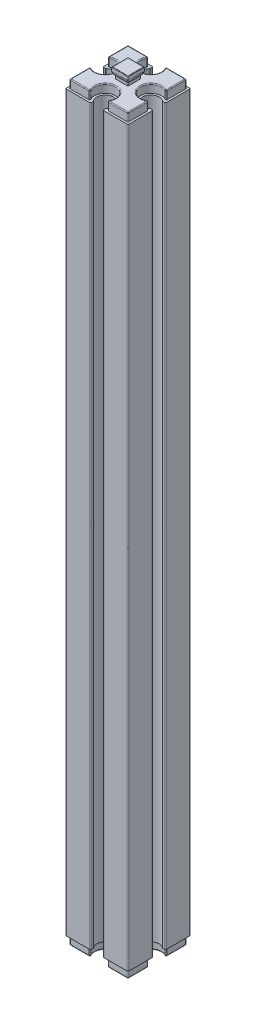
SolidWorks part; units mm, degrees
ref_plane "前视基准面" through (0, 0, 0) normal (0, 0, 1) x (1, 0, 0)
ref_plane "上视基准面" through (0, 0, 0) normal (0, 1, 0) x (1, 0, 0)
ref_plane "右视基准面" through (0, 0, 0) normal (1, 0, 0) x (0, 0, -1)
sketch "草图1" plane through (0, 0, 0) normal (0, 1, 0) x (1, 0, 0)
  line L0 (0, 0) -> (0, 7.5) construction
  line L1 (0, 0) -> (7.5, 0) construction
  line L2 (-7.5, 7.5) -> (-1.5, 7.5)
  line L3 (7.5, 7.5) -> (7.5, 1.5)
  line L4 (6.8229, 1.5) -> (7.5, 1.5)
  line L5 (6.8229, -1.5) -> (7.5, -1.5)
  line L6 (0, 7.5) -> (0, 5.5) construction
  line L7 (-1.5, 6.8229) -> (-1.5, 7.5)
  line L8 (1.5, 6.8229) -> (1.5, 7.5)
  line L9 (1.5, 7.5) -> (7.5, 7.5)
  line L10 (7.5, -1.5) -> (7.5, -7.5)
  line L11 (7.5, -7.5) -> (1.5, -7.5)
  line L12 (1.5, -6.8229) -> (1.5, -7.5)
  line L13 (-1.5, -6.8229) -> (-1.5, -7.5)
  line L14 (-1.5, -7.5) -> (-7.5, -7.5)
  line L15 (-7.5, -7.5) -> (-7.5, -1.5)
  line L16 (-6.8229, -1.5) -> (-7.5, -1.5)
  line L17 (-6.8229, 1.5) -> (-7.5, 1.5)
  line L18 (-7.5, 1.5) -> (-7.5, 7.5)
  arc A0 (-1.5, 6.8229) -> (1.5, 6.8229) centre (0, 5.5) ccw
  arc A1 (6.8229, 1.5) -> (6.8229, -1.5) centre (5.5, 0) ccw
  arc A2 (1.5, -6.8229) -> (-1.5, -6.8229) centre (0, -5.5) ccw
  arc A3 (-6.8229, -1.5) -> (-6.8229, 1.5) centre (-5.5, 0) ccw
  point P36 (0, 0)
  dimension "D6" = 4
  dimension "D7" = 2
  dimension "D1" = 7.5
  dimension "D2" = 7.5
  dimension "D3" = 2
  dimension "D4" = 7.5
  dimension "D5" = 1.5
extrude "凸台-拉伸1" add sketch "草图1" along normal blind 88
sketch "草图2" plane through (0, 88, 0) normal (0, 1, 0) x (1, 0, 0)
  line L0 (-7, 7) -> (-7, 2)
  line L1 (-7, 2) -> (-7, 2)
  line L2 (-7, -2) -> (-7, -2)
  line L3 (-7, -2) -> (-7, -7)
  line L4 (-7, -7) -> (-2, -7)
  line L5 (-2, -7) -> (-2, -7)
  line L6 (2, -7) -> (2, -7)
  line L7 (2, -7) -> (7, -7)
  line L8 (7, -7) -> (7, -2)
  line L9 (7, -2) -> (7, -2)
  line L10 (7, 2) -> (7, 2)
  line L11 (7, 2) -> (7, 7)
  line L12 (7, 7) -> (2, 7)
  line L13 (2, 7) -> (2, 7)
  line L14 (-2, 7) -> (-2, 7)
  line L15 (-2, 7) -> (-7, 7)
  line L16 (-7.5, 7.5) -> (-7.5, 1.5)
  line L17 (-7.5, 1.5) -> (-6.8229, 1.5)
  line L18 (-6.8229, -1.5) -> (-7.5, -1.5)
  line L19 (-7.5, -1.5) -> (-7.5, -7.5)
  line L20 (-7.5, -7.5) -> (-1.5, -7.5)
  line L21 (-1.5, -7.5) -> (-1.5, -6.8229)
  line L22 (1.5, -6.8229) -> (1.5, -7.5)
  line L23 (1.5, -7.5) -> (7.5, -7.5)
  line L24 (7.5, -7.5) -> (7.5, -1.5)
  line L25 (7.5, -1.5) -> (6.8229, -1.5)
  line L26 (6.8229, 1.5) -> (7.5, 1.5)
  line L27 (7.5, 1.5) -> (7.5, 7.5)
  line L28 (7.5, 7.5) -> (1.5, 7.5)
  line L29 (1.5, 7.5) -> (1.5, 6.8229)
  line L30 (-1.5, 6.8229) -> (-1.5, 7.5)
  line L31 (-1.5, 7.5) -> (-7.5, 7.5)
  line L32 (-7.5, 7.5) -> (-7.5, 1.5) construction
  line L33 (-7.5, 1.5) -> (-6.8229, 1.5) construction
  line L34 (-6.8229, -1.5) -> (-7.5, -1.5) construction
  line L35 (-7.5, -1.5) -> (-7.5, -7.5) construction
  line L36 (-7.5, -7.5) -> (-1.5, -7.5) construction
  line L37 (-1.5, -7.5) -> (-1.5, -6.8229) construction
  line L38 (1.5, -6.8229) -> (1.5, -7.5) construction
  line L39 (1.5, -7.5) -> (7.5, -7.5) construction
  line L40 (7.5, -7.5) -> (7.5, -1.5) construction
  line L41 (7.5, -1.5) -> (6.8229, -1.5) construction
  line L42 (6.8229, 1.5) -> (7.5, 1.5) construction
  line L43 (7.5, 1.5) -> (7.5, 7.5) construction
  line L44 (7.5, 7.5) -> (1.5, 7.5) construction
  line L45 (1.5, 7.5) -> (1.5, 6.8229) construction
  line L46 (-1.5, 6.8229) -> (-1.5, 7.5) construction
  line L47 (-1.5, 7.5) -> (-7.5, 7.5) construction
  arc A0 (-7, -2) -> (-7, 2) centre (-5.5, 0) ccw
  arc A1 (2, -7) -> (-2, -7) centre (0, -5.5) ccw
  arc A2 (7, 2) -> (7, -2) centre (5.5, 0) ccw
  arc A3 (-2, 7) -> (2, 7) centre (0, 5.5) ccw
  arc A4 (-6.8229, -1.5) -> (-6.8229, 1.5) centre (-5.5, 0) ccw
  arc A5 (1.5, -6.8229) -> (-1.5, -6.8229) centre (0, -5.5) ccw
  arc A6 (6.8229, 1.5) -> (6.8229, -1.5) centre (5.5, 0) ccw
  arc A7 (-1.5, 6.8229) -> (1.5, 6.8229) centre (0, 5.5) ccw
  arc A8 (-6.8229, -1.5) -> (-6.8229, 1.5) centre (-5.5, 0) ccw construction
  arc A9 (1.5, -6.8229) -> (-1.5, -6.8229) centre (0, -5.5) ccw construction
  arc A10 (6.8229, 1.5) -> (6.8229, -1.5) centre (5.5, 0) ccw construction
  arc A11 (-1.5, 6.8229) -> (1.5, 6.8229) centre (0, 5.5) ccw construction
  dimension "D1" = 0
  dimension "D2" = 0.5
extrude "凸台-拉伸2" add sketch "草图2" along normal blind 2
sketch "草图3" plane through (0, 0, 0) normal (1, 0, 0) x (0, 0, -1)
  line L0 (0, 90) -> (0, 92) construction
  line L1 (2.5, 90) -> (-2.5, 90) construction
  line L2 (0, 92) -> (0, 92.5) construction
  line L3 (-1.5, 90) -> (1.5, 90)
  line L4 (1.5, 90) -> (1.5, 90.6771)
  line L5 (-1.95, 92.5) -> (1.95, 92.5)
  line L6 (1.95, 92.5) -> (1.95, 91.5556)
  line L7 (-1.5, 90) -> (-1.5, 90.6771)
  line L8 (-1.95, 92.5) -> (-1.95, 91.5556)
  arc A0 (-1.5, 90.6771) -> (-1.95, 91.5556) centre (0, 92) cw
  arc A1 (1.5, 90.6771) -> (1.95, 91.5556) centre (0, 92) ccw
  dimension "D5" = 2
  dimension "D1" = 2
  dimension "D2" = 0.5
  dimension "D3" = 1.5
  dimension "D4" = 1.95
extrude "凸台-拉伸3" add sketch "草图3" along normal blind 2 and the other way blind 2
sketch "草图4" plane through (0, 0, 0) normal (0, 0, 1) x (1, 0, 0)
  line L0 (0, 90) -> (0, 92) construction
  line L2 (-2, 90) -> (2, 90) construction
  line L3 (0, 92) -> (0, 92.5) construction
  line L4 (-2, 92.5) -> (2, 92.5) construction
  line L5 (1.95, 92.5) -> (2, 92.5)
  line L6 (-1.95, 92.5) -> (-1.95, 91.5556)
  line L9 (-1.5, 90) -> (-1.5, 90.6771)
  line L10 (1.5, 90) -> (1.5, 90.6771)
  line L11 (1.95, 92.5) -> (1.95, 91.5556)
  line L12 (1.5, 90) -> (2, 90)
  line L13 (-2, 92.5) -> (-1.95, 92.5)
  line L14 (-2, 92.5) -> (-2, 90)
  line L15 (-2, 90) -> (-1.5, 90)
  line L16 (2, 92.5) -> (2, 90)
  arc A0 (-1.95, 91.5556) -> (-1.5, 90.6771) centre (0, 92) ccw
  arc A1 (1.95, 91.5556) -> (1.5, 90.6771) centre (0, 92) cw
  dimension "D1" = 2
  dimension "D2" = 1.5
  dimension "D3" = 1.95
fillet "圆角3" radius 0.2 13 edges at (-1.5, 44, -7.5) (1.5, 44, -7.5) (7.5, 44, -7.5) (7.5, 44, -1.5) (7.5, 44, 1.5) (7.5, 44, 7.5) (-1.5, 44, 7.5) (1.5, 44, 7.5) (-6.8229, 44, -1.5) (-7.5, 44, 7.5) (-7.5, 44, 1.5) (-7.5, 44, -1.5) (-7.5, 44, -7.5)
extrude "切除-拉伸1" cut sketch "草图4" against normal blind 3 and the other way blind 3
fillet "圆角4" radius 0.2 24 edges at (0, 90, 3) (-3, 90, 0) (0, 90, -3) (3, 90, 0) (7, 89, 2) (7, 89, -2) (2, 89, -7) (-2, 89, -7) (-7, 89, 2) (-7, 89, -2) (2, 89, 7) (-2, 89, 7) (7, 89, 7) (4.5, 90, 7) (7, 90, 4.5) (7, 90, -4.5) (7, 89, -7) (4.5, 90, -7) (-4.5, 90, -7) (-7, 89, -7) (-7, 90, -4.5) (-4.5, 90, 7) (-7, 90, 4.5) (-7, 89, 7)
fillet "圆角5" radius 0.1 4 edges at (0, 92.5, -1.95) (1.95, 92.5, 0) (0, 92.5, 1.95) (-1.95, 92.5, 0)
mirror "镜向1" of "圆角5", "圆角4", "切除-拉伸1", "圆角3", "凸台-拉伸3", "凸台-拉伸2", "凸台-拉伸1"
